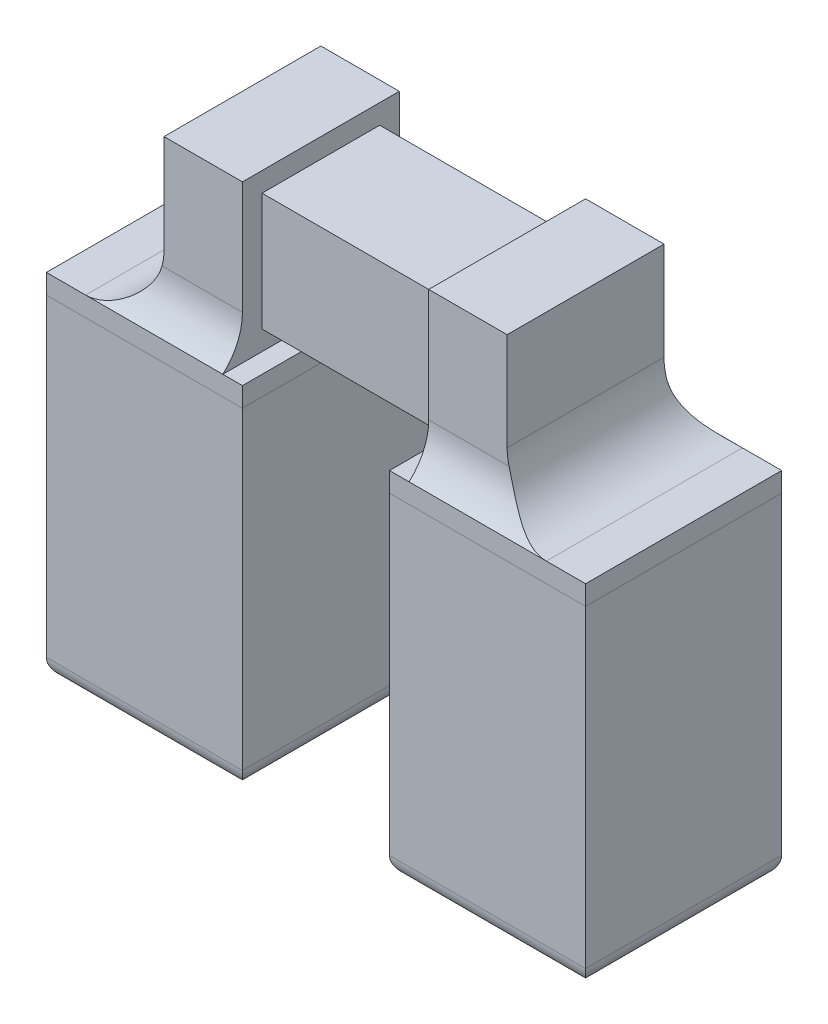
SolidWorks part; units mm, degrees
ref_plane "Plan de face" through (0, 0, 0) normal (0, 0, 1) x (1, 0, 0)
ref_plane "Plan de dessus" through (0, 0, 0) normal (0, 1, 0) x (1, 0, 0)
ref_plane "Plan de droite" through (0, 0, 0) normal (1, 0, 0) x (0, 0, -1)
sketch "Esquisse1" plane through (0, 0, 0) normal (0, 1, 0) x (1, 0, 0)
  line L0 (-0.375, 0) -> (0.375, 0) construction
  line L1 (-0.375, 0.5) -> (-1.375, 0.5)
  line L2 (-0.375, 0.5) -> (-0.375, -0.5)
  line L3 (-0.375, -0.5) -> (-1.375, -0.5)
  line L4 (-1.375, 0.5) -> (-1.375, -0.5)
  line L5 (0.375, 0.5) -> (1.375, 0.5)
  line L6 (0.375, 0.5) -> (0.375, -0.5)
  line L7 (0.375, -0.5) -> (1.375, -0.5)
  line L8 (1.375, 0.5) -> (1.375, -0.5)
  point P10 (0, 0)
  dimension "D1" = 1
  dimension "D2" = 0.75
extrude "Boss.-Extru.1" add sketch "Esquisse1" along normal blind 0.1
sketch "Esquisse3" plane through (0, 0.1, 0) normal (0, 1, 0) x (1, 0, 0)
  line L0 (-0.375, -0.5) -> (-0.375, 0.5) construction
  line L1 (-0.875, 0.4) -> (-0.475, 0.4)
  line L2 (-0.875, 0.4) -> (-0.875, -0.4)
  line L3 (-0.875, -0.4) -> (-0.475, -0.4)
  line L4 (-0.475, 0.4) -> (-0.475, -0.4)
  line L5 (0.475, 0.4) -> (0.875, 0.4)
  line L6 (0.475, 0.4) -> (0.475, -0.4)
  line L7 (0.475, -0.4) -> (0.875, -0.4)
  line L8 (0.875, 0.4) -> (0.875, -0.4)
  line L9 (0.375, 0.5) -> (0.375, -0.5) construction
  point P8 (-0.475, 0)
  dimension "D1" = 0.8
  dimension "D2" = 0.4
  dimension "D3" = 0.1
  dimension "D4" = 0.1
extrude "Boss.-Extru.2" add sketch "Esquisse3" along normal blind 0.8
fillet "Congé1" radius 0.3 3 edges at (-0.675, 0.1, -0.4) (-0.875, 0.1, 0) (-0.675, 0.1, 0.4)
fillet "Congé2" radius 0.3 3 edges at (0.675, 0.1, -0.4) (0.875, 0.1, 0) (0.675, 0.1, 0.4)
sketch "Esquisse4" plane through (-0.475, 0, 0) normal (1, 0, 0) x (0, 0, -1)
  line L0 (-0.4, 0.9) -> (-0.4, 0.4) construction
  line L1 (-0.3, 0.8) -> (0.3, 0.8)
  line L2 (-0.3, 0.8) -> (-0.3, 0.2)
  line L3 (-0.3, 0.2) -> (0.3, 0.2)
  line L4 (0.3, 0.8) -> (0.3, 0.2)
  line L5 (-0.4, 0.9) -> (0.4, 0.9) construction
  line L6 (-0.5, 0.1) -> (0.5, 0.1) construction
  line L7 (0.4, 0.9) -> (0.4, 0.4) construction
  dimension "D1" = 0.1
  dimension "D2" = 0.1
  dimension "D3" = 0.1
  dimension "D4" = 0.1
extrude "Boss.-Extru.3" add sketch "Esquisse4" along normal up to next separate body
sketch "Esquisse5" plane through (0, 0, 0) normal (0, -1, 0) x (1, 0, 0)
  line L1 (-1.375, 0.5) -> (-0.375, 0.5)
  line L2 (-1.375, 0.5) -> (-1.375, -0.5)
  line L3 (-1.375, -0.5) -> (-0.375, -0.5)
  line L4 (-0.375, 0.5) -> (-0.375, -0.5)
  line L5 (0.375, 0.5) -> (1.375, 0.5)
  line L6 (0.375, 0.5) -> (0.375, -0.5)
  line L7 (0.375, -0.5) -> (1.375, -0.5)
  line L8 (1.375, 0.5) -> (1.375, -0.5)
extrude "Boss.-Extru.4" add sketch "Esquisse5" along normal blind 1.7 separate body
fillet "Congé3" radius 0.1 4 edges at (-0.375, -1.7, 0) (-0.875, -1.7, 0.5) (-1.375, -1.7, 0) (-0.875, -1.7, -0.5)
fillet "Congé4" radius 0.1 4 edges at (1.375, -1.7, 0) (0.875, -1.7, -0.5) (0.375, -1.7, 0) (0.875, -1.7, 0.5)
